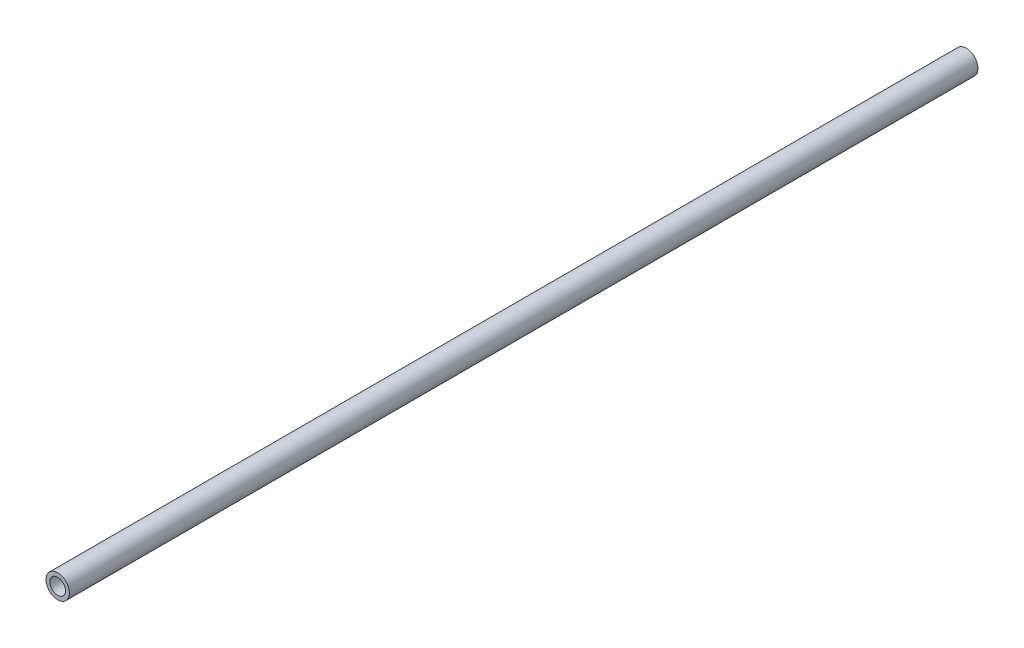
SolidWorks part; units mm, degrees
ref_plane "Plan de face" through (0, 0, 0) normal (0, 0, 1) x (1, 0, 0)
ref_plane "Plan de dessus" through (0, 0, 0) normal (0, 1, 0) x (1, 0, 0)
ref_plane "Plan de droite" through (0, 0, 0) normal (1, 0, 0) x (0, 0, -1)
sketch "Esquisse1" plane through (0, 0, 0) normal (0, 0, 1) x (1, 0, 0)
  circle A0 centre (0, 0) radius 3
  circle A1 centre (0, 0) radius 2
  dimension "D1" = 6
  dimension "D2" = 1
extrude "Boss.-Extru.1" add sketch "Esquisse1" along normal mid plane 232.8
